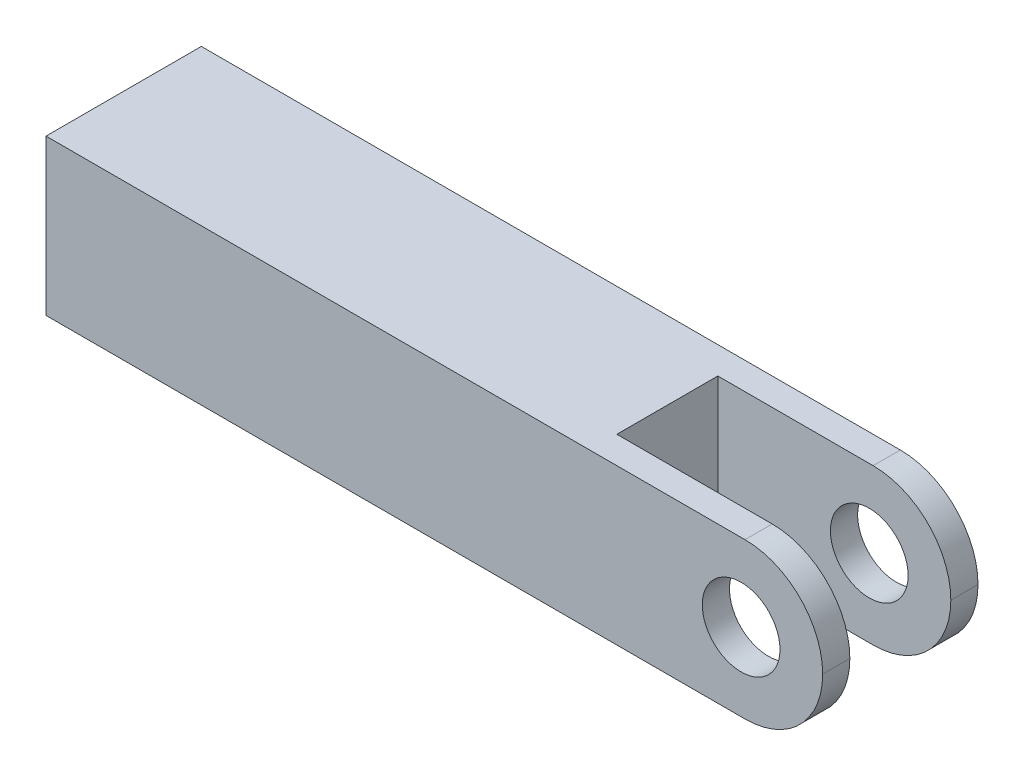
SolidWorks part; units mm, degrees
ref_plane "Front Plane" through (0, 0, 0) normal (0, 0, 1) x (1, 0, 0)
ref_plane "Top Plane" through (0, 0, 0) normal (0, 1, 0) x (1, 0, 0)
ref_plane "Right Plane" through (0, 0, 0) normal (1, 0, 0) x (0, 0, -1)
sketch "Sketch2" plane through (0, 0, 0) normal (0, 0, 1) x (1, 0, 0)
  line L1 (-100, -20) -> (100, -20)
  line L2 (-100, -20) -> (-100, 20)
  line L3 (-100, 20) -> (100, 20)
  line L4 (100, -20) -> (100, 20)
  dimension "D1" = 200
  dimension "D2" = 40
  dimension "D3" = 100
  dimension "D4" = 20
extrude "Extrude1" add sketch "Sketch2" along normal mid plane 40
fillet "Fillet1" radius 20 4 edges at (100, 0, 20) (100, 0, -20) (100, 20, 0) (100, -20, 0)
sketch "Sketch5" plane through (0, 20, 0) normal (0, 1, 0) x (-1, 0, 0)
  line L0 (-100, 0) -> (-411.5238, 0) construction
  line L1 (-100, -20) -> (-100, 20) construction
  line L3 (-100, -13) -> (-40, -13)
  line L4 (-100, -13) -> (-100, 13)
  line L5 (-100, 13) -> (-40, 13)
  line L6 (-40, -13) -> (-40, 13)
  dimension "D1" = 26
  dimension "D2" = 13
  dimension "D3" = 60
extrude "Cut-Extrude3" cut sketch "Sketch5" against normal through all
sketch "Sketch6" plane through (0, 0, 20) normal (0, 0, 1) x (1, 0, 0)
  circle A0 centre (79.0062, 0) radius 10
  dimension "D1" = 20
extrude "Cut-Extrude4" cut sketch "Sketch6" against normal through all
equation "\"D3@Sketch2\" = \"D1@Sketch2\"/2"
equation "\"D4@Sketch2\" = \"D2@Sketch2\"/2"
